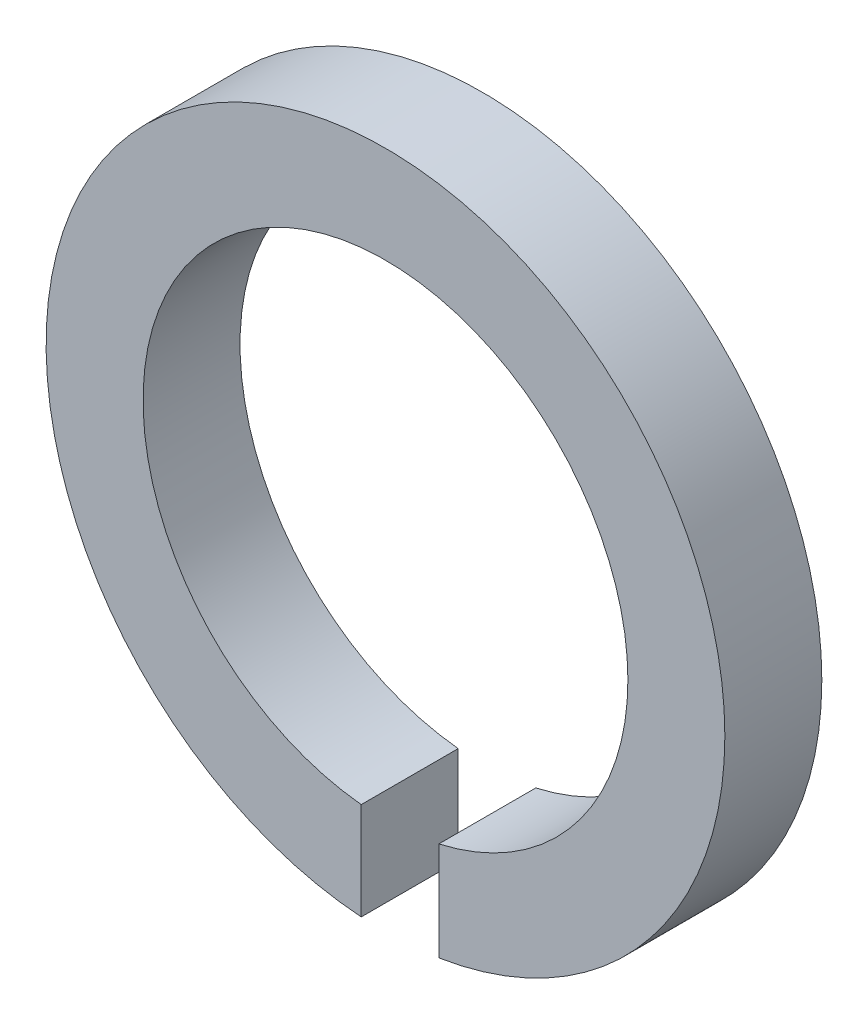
SolidWorks part; units mm, degrees
ref_plane "Front" through (0, 0, 0) normal (0, 0, 1) x (1, 0, 0)
ref_plane "Top" through (0, 0, 0) normal (0, 1, 0) x (1, 0, 0)
ref_plane "Right" through (0, 0, 0) normal (1, 0, 0) x (0, 0, -1)
sketch "Sketch1" plane through (0, 0, 0) normal (0, 0, 1) x (1, 0, 0)
  circle A0 centre (0, 0) radius 1.5
  circle A1 centre (0, 0) radius 2.1
  dimension "d" = 3
  dimension "b" = 0.6
extrude "Base-Extrude" add sketch "Sketch1" against normal blind 0.6
sketch "Sketch2" plane through (0, 0, 0) normal (0, 1, 0) x (1, 0, 0)
  line L1 (-0.15, 0.6) -> (0.33, 0.6)
  line L2 (2.1, 0.6) -> (-2.1, 0.6) construction
  line L3 (-0.15, 0.6) -> (-0.15, 0)
  line L4 (-1.5, 0) -> (1.5, 0) construction
  line L5 (-0.15, 0) -> (0.33, 0)
  line L7 (0.33, 0.6) -> (0.33, 0)
  dimension "D2" = 0.15
  dimension "m" = 0.48
extrude "Cut-Extrude1" cut sketch "Sketch2" against normal through all
equation "\"m@Sketch2\" = \"S@Base-Extrude\" * 0.8"
